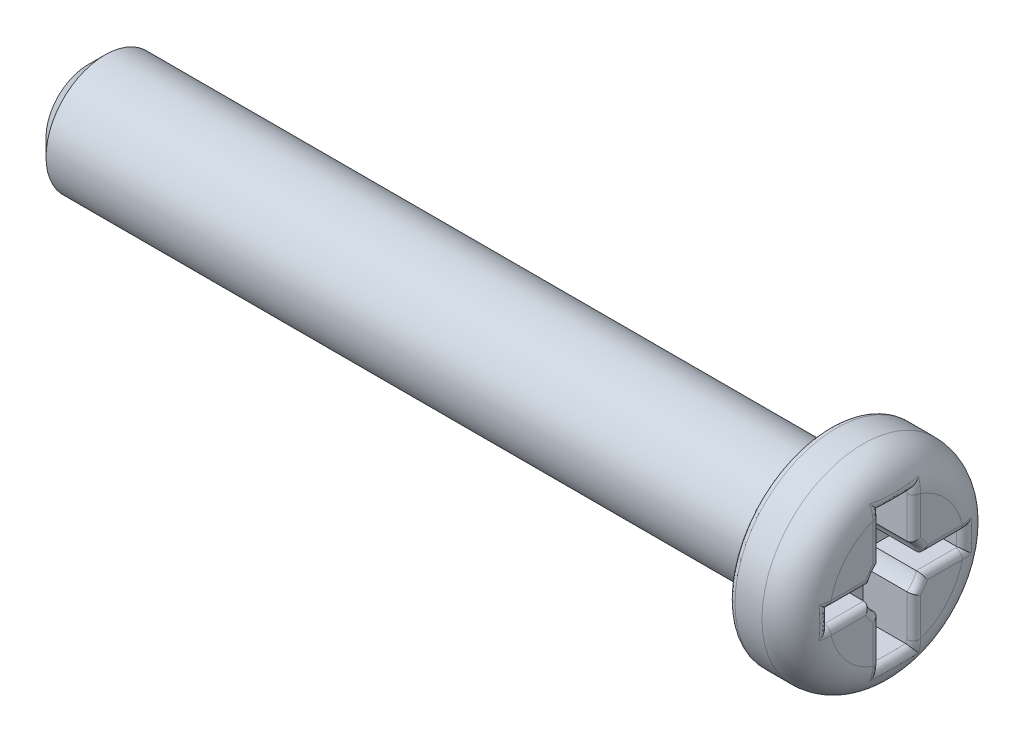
SolidWorks part; units mm, degrees
ref_plane "Face" through (0, 0, 0) normal (0, 0, 1) x (1, 0, 0)
ref_plane "Dessus" through (0, 0, 0) normal (0, 1, 0) x (1, 0, 0)
ref_plane "Droite" through (0, 0, 0) normal (1, 0, 0) x (0, 0, -1)
sketch "Esquisse1" plane through (0, 0, 0) normal (0, 0, 1) x (1, 0, 0)
  line L0 (0, 0) -> (47.414, 0) construction
  line L1 (0, 0) -> (0, 1.75)
  line L2 (0, 1.75) -> (22, 1.75)
  line L3 (22, 1.75) -> (22, 3)
  line L4 (22, 3) -> (23, 3)
  line L5 (24, 2) -> (24, 0)
  line L6 (0, 0) -> (24, 0)
  arc A0 (24, 2) -> (23, 3) centre (23, 2) ccw
  point P10 (24, 3)
  dimension "D5" = 1
  dimension "D1" = 1.75
  dimension "D2" = 22
  dimension "D3" = 2
  dimension "D4" = 3
revolve "Révolution1" add sketch "Esquisse1" angle 360 about L0
chamfer "Chanfrein1" distance 0.5 angle 45
sketch "Esquisse2" plane through (24, 0, 0) normal (1, 0, 0) x (0, 0, -1)
  line L0 (0, 0) -> (0, 3.3009) construction
  line L1 (-2.9227, 0) -> (2.9227, 0) construction
  line L2 (-0.5, -2) -> (-0.5, 2)
  line L3 (0.5, -2) -> (0.5, 2)
  line L4 (-0.5, 2) -> (0.5, 2)
  line L5 (-0.5, -2) -> (0.5, -2)
  point P8 (0, 2)
  point P11 (-0.5, 0)
  point P12 (0.5, 0)
  dimension "D1" = 1
  dimension "D2" = 4
extrude "Enlèv. mat.-Extru.1" cut sketch "Esquisse2" against normal blind 1.5
sketch "Esquisse3" plane through (24, 0, 0) normal (1, 0, 0) x (0, 0, -1)
  line L0 (-3.4414, 0) -> (3.6467, 0) construction
  line L1 (-2, -0.25) -> (-2, 0.25)
  line L2 (-2, 0.25) -> (2, 0.25)
  line L3 (0, 0) -> (0, 2.1556) construction
  line L4 (-2, -0.25) -> (2, -0.25)
  line L5 (2, -0.25) -> (2, 0.25)
  point P10 (-2, 0)
  point P11 (0, -0.25)
  point P12 (0, 0.25)
  dimension "D1" = 0.5
  dimension "D2" = 4
extrude "Enlèv. mat.-Extru.2" cut sketch "Esquisse3" against normal up to surface (1.5 mm away)
sketch "Esquisse4" plane through (24, 0, 0) normal (1, 0, 0) x (0, 0, -1)
  circle A0 centre (0, 0) radius 0.82
extrude "Enlèv. mat.-Extru.3" cut sketch "Esquisse4" against normal up to surface (1.5 mm away)
fillet "Congé1" radius 0.2
